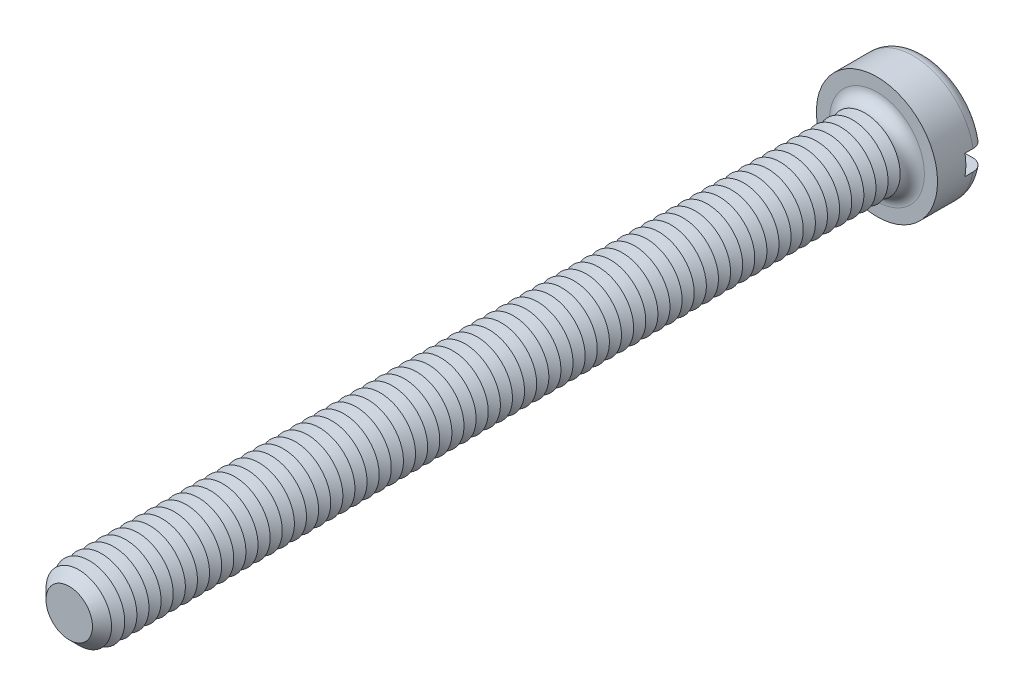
SolidWorks part; units mm, degrees
ref_plane "Front Plane" through (0, 0, 0) normal (0, 0, 1) x (1, 0, 0)
ref_plane "Top Plane" through (0, 0, 0) normal (0, 1, 0) x (1, 0, 0)
ref_plane "Right Plane" through (0, 0, 0) normal (1, 0, 0) x (0, 0, -1)
sketch "Sketch3" plane through (0, 0, 0) normal (0, 0, 1) x (1, 0, 0)
  circle A0 centre (0, 0) radius 3
  dimension "D1" = 6
extrude "Boss-Extrude2" add sketch "Sketch3" against normal blind 2.4
sketch "Sketch4" plane through (0, 0, 0) normal (0, 0, 1) x (1, 0, 0)
  circle A0 centre (0, 0) radius 1.75
  dimension "D1" = 3.5
extrude "Boss-Extrude3" add sketch "Sketch4" along normal blind 40
fillet "Fillet1" radius 0.6 2 edges at (3, 0, -2.4) (1.75, 0, 0)
chamfer "Chamfer1" distance 0.6 angle 45 1 edges at (1.75, 0, 40)
sketch "Sketch5" plane through (0, 0, 0) normal (1, 0, 0) x (0, 0, -1)
  line L0 (1.6944, 0) -> (-7.6738, 0) construction
sketch "Sketch6" plane through (0, 0, 0) normal (1, 0, 0) x (0, 0, -1)
  line L0 (-0.6, 1.75) -> (-0.9, 1.2304)
  line L1 (-0.9, 1.2304) -> (-1.2, 1.75)
  line L2 (-0.6, 1.75) -> (-39.4, 1.75) construction
  line L3 (-1.2, 1.75) -> (-0.6, 1.75)
  dimension "D1" = 0.6
revolve "Cut-Revolve1" cut sketch "Sketch6" angle 360 about L0
pattern_linear "LPattern1" count 65 spacing 0.6 along (0, 0, 1) of "Cut-Revolve1"
sketch "Sketch8" plane through (0, 0, -2.4) normal (0, 0, -1) x (-1, 0, 0)
  line L1 (3, -0.5) -> (-3, -0.5)
  line L2 (3, -0.5) -> (3, 0.5)
  line L3 (3, 0.5) -> (-3, 0.5)
  line L4 (-3, -0.5) -> (-3, 0.5)
  line L5 (3, -0.5) -> (-3, 0.5) construction
  line L6 (3, 0.5) -> (-3, -0.5) construction
  point P0 (0, 0)
  dimension "D1" = 6
  dimension "D2" = 1
extrude "Cut-Extrude1" cut sketch "Sketch8" against normal blind 1
